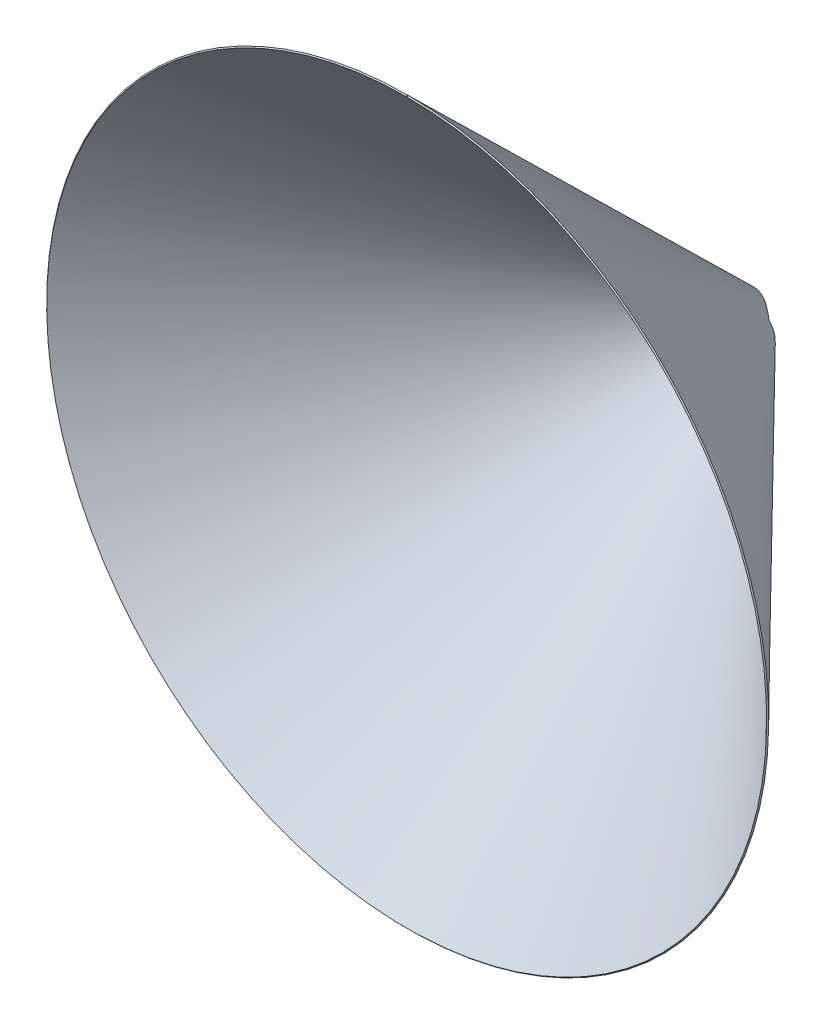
SolidWorks part; units mm, degrees
ref_plane "Ebene vorne" through (0, 0, 0) normal (0, 0, 1) x (1, 0, 0)
ref_plane "Ebene oben" through (0, 0, 0) normal (0, 1, 0) x (1, 0, 0)
ref_plane "Ebene rechts" through (0, 0, 0) normal (1, 0, 0) x (0, 0, -1)
sketch "Skizze1" plane through (0, 0, 0) normal (0, 0, 1) x (1, 0, 0)
  line L0 (0, 0) -> (-0.0052, 6) construction
  line L1 (-0.0052, 6) -> (0.0052, 6) construction
  line L2 (0.0052, 6) -> (0, 0) construction
  arc A0 (-0.0044, 5) -> (0.0044, 5) centre (0, 0) ccw
  dimension "D1" = 10
  dimension "D3" = 6
  dimension "D2" = 0.1
ref_plane "Ebene1" through (0, 0, 250) normal (0, 0, 1) x (1, 0, 0)
sketch "Skizze2" plane through (0, 0, 250) normal (0, 0, 1) x (1, 0, 0)
  line L0 (0, 0) -> (-0.1284, 147.0791) construction
  line L1 (-0.1284, 147.0791) -> (0.1284, 147.0791) construction
  line L2 (0.1284, 147.0791) -> (0, 0) construction
  arc A0 (-0.2182, 249.9999) -> (0.2182, 249.9999) centre (0, 0) ccw
  dimension "D1" = 500
  dimension "D2" = 0.1
sheet metal parameters "Blech1" thickness 1 parameters "D1"=1
lofted bend "Ausgeformte Biegungen1" thickness 1 parameters "D1"=0
other "Freiform-Biegung1" parameters "D1"=1000, "D4"=359.9, "D5"=1
sketch "Skizze6" plane through (0, 0, 250) normal (0, 0, 1) x (1, 0, 0)
  line L1 (-25, -15) -> (25, -15)
  line L2 (-25, -15) -> (-25, 15)
  line L3 (-25, 15) -> (25, 15)
  line L4 (25, -15) -> (25, 15)
  line L5 (-25, -15) -> (25, 15) construction
  line L6 (-25, 15) -> (25, -15) construction
  point P0 (0, 0)
  dimension "D1" = 30
  dimension "D2" = 50
extrude "Schnitt-Linear austragen1" cut sketch "Skizze6" against normal through all
flat pattern "Abwicklung1"
sketch "Biegung-Linien1" plane through (0, 0, 0) normal (0, 1, 0) x (-1, 0, 0)
sketch3d "Rahmen1" [suppressed]
  line L0 (-379.0191, -165.0423, 0) -> (40.1392, 412.1517, 0) construction
  line L1 (79.0181, -497.6689, 0) -> (498.1764, 79.5251, 0) construction
  line L2 (-379.0191, -165.0423, 0) -> (79.0181, -497.6689, 0) construction
  line L3 (40.1392, 412.1517, 0) -> (498.1764, 79.5251, 0) construction
other "Abwickeln-<Freiform-Biegung1>1"
